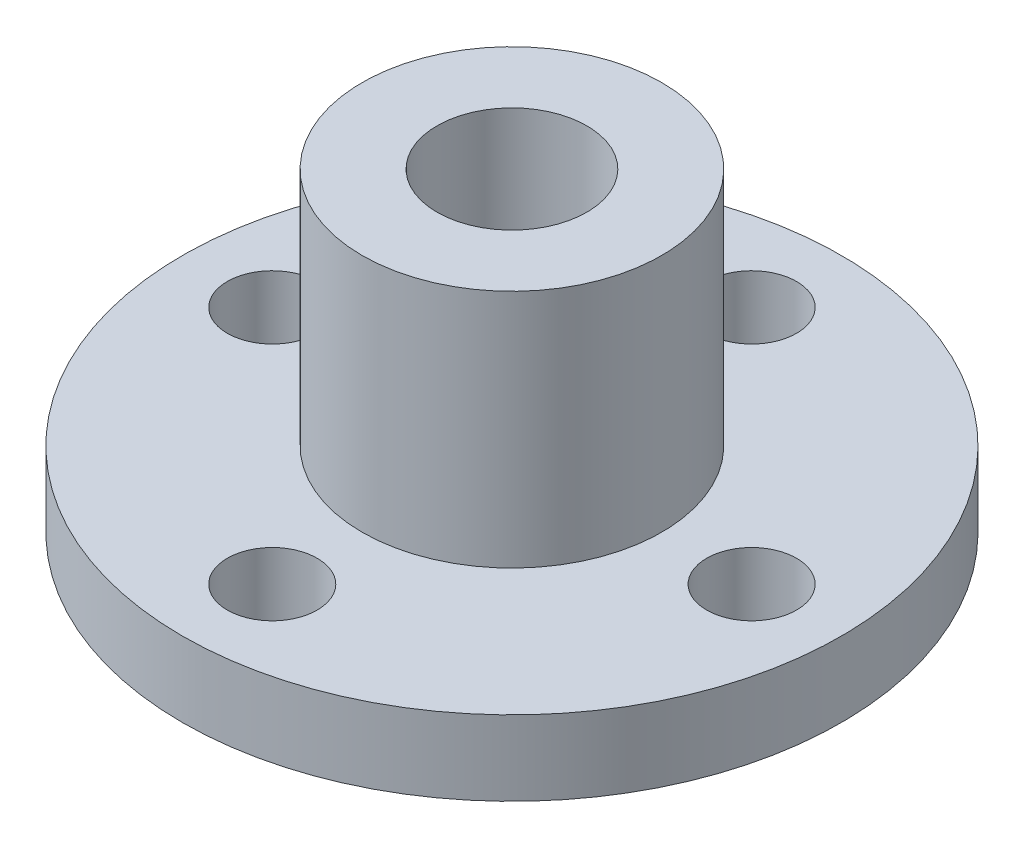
SolidWorks part; units mm, degrees
ref_plane "前视基准面" through (0, 0, 0) normal (0, 0, 1) x (1, 0, 0)
ref_plane "上视基准面" through (0, 0, 0) normal (0, 1, 0) x (1, 0, 0)
ref_plane "右视基准面" through (0, 0, 0) normal (1, 0, 0) x (0, 0, -1)
sketch "草图2" plane through (0, 0, 0) normal (0, 1, 0) x (1, 0, 0)
  circle A0 centre (0, 0) radius 11
  dimension "D1" = 22
extrude "凸台-拉伸1" add sketch "草图2" along normal blind 2.5
sketch "草图3" plane through (0, 2.5, 0) normal (0, 1, 0) x (1, 0, 0)
  line L0 (0, 0) -> (0, 11.778) construction
  circle A0 centre (0, 0) radius 8 construction
  circle A1 centre (0, 8) radius 1.5
  circle A2 centre (8, 0) radius 1.5
  circle A3 centre (0, -8) radius 1.5
  circle A4 centre (-8, 0) radius 1.5
  point P15 (0, 0)
  dimension "D1" = 16
  dimension "D2" = 3
  dimension "D3" = 4
extrude "切除-拉伸1" cut sketch "草图3" against normal through all both and the other way through all
sketch "草图4" plane through (0, 2.5, 0) normal (0, 1, 0) x (1, 0, 0)
  circle A0 centre (0, 0) radius 5
  dimension "D1" = 10
extrude "凸台-拉伸2" add sketch "草图4" along normal blind 8
sketch "草图6" plane through (0, 10.5, 0) normal (0, 1, 0) x (1, 0, 0)
  circle A0 centre (0, 0) radius 2.5
  dimension "D1" = 5
extrude "切除-拉伸2" cut sketch "草图6" against normal through all both and the other way through all
sketch "草图7" plane through (0, 10.5, 0) normal (0, 1, 0) x (1, 0, 0)
  line L0 (0, 0) -> (13.5019, 0) construction
  line L1 (0, 0) -> (3.5355, 3.5355) construction
  circle A0 centre (0, 0) radius 5 construction
  dimension "D1" = 45
sketch "草图8" plane through (0, 2.5, 0) normal (0, 1, 0) x (1, 0, 0)
  line L0 (-11, 12.9558) -> (-11, -12.9268) construction
  circle A0 centre (0, 0) radius 11 construction
